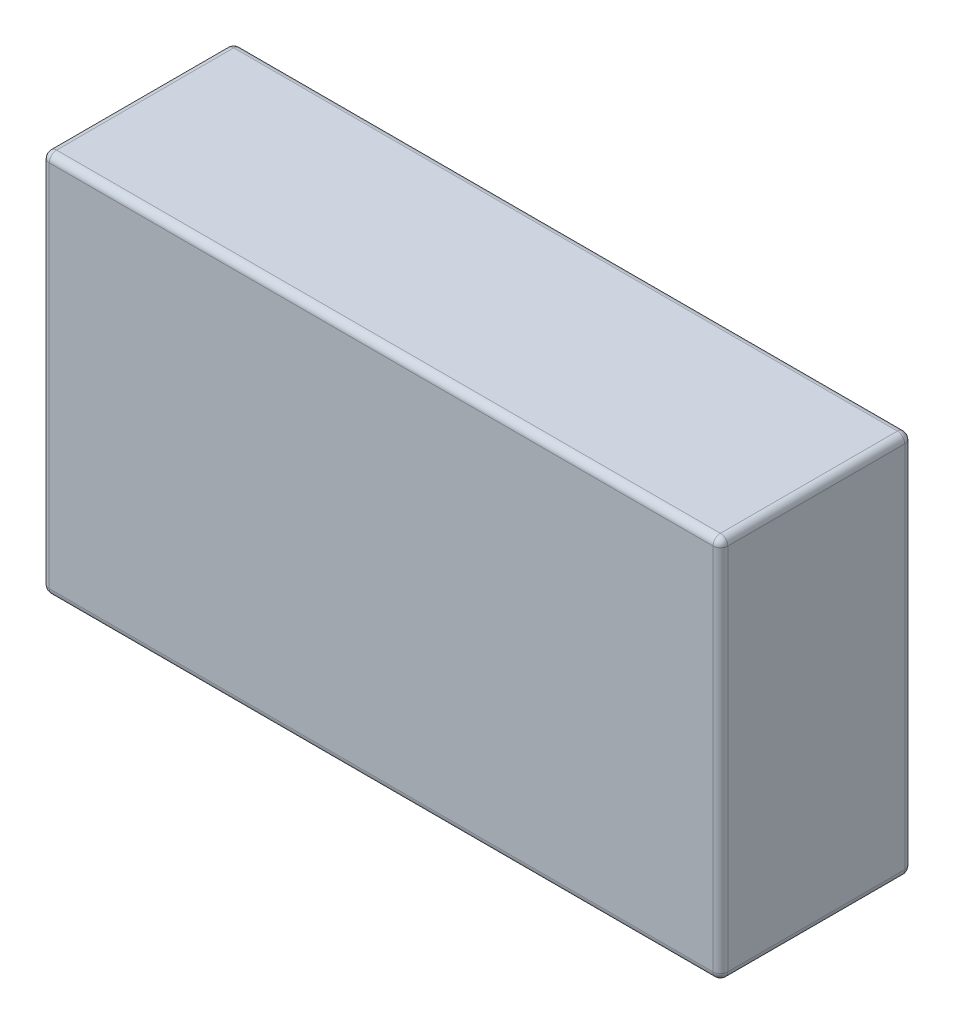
SolidWorks part; units mm, degrees
ref_plane "Alzado" through (0, 0, 0) normal (0, 0, 1) x (1, 0, 0)
ref_plane "Planta" through (0, 0, 0) normal (0, 1, 0) x (1, 0, 0)
ref_plane "Vista lateral" through (0, 0, 0) normal (1, 0, 0) x (0, 0, -1)
sketch "Croquis1" plane through (0, 0, 0) normal (0, 0, 1) x (1, 0, 0)
  line L1 (0, 0) -> (46, 0)
  line L2 (0, 0) -> (0, 26)
  line L3 (0, 26) -> (46, 26)
  line L4 (46, 0) -> (46, 26)
  dimension "D1" = 46
  dimension "D2" = 26
extrude "Saliente-Extruir1" add sketch "Croquis1" along normal blind 13
fillet "Redondeo1" radius 0.5 12 edges at (0, 0, 6.5) (23, 0, 0) (0, 13, 0) (0, 26, 6.5) (23, 26, 0) (46, 0, 6.5) (46, 26, 6.5) (46, 13, 0) (23, 26, 13) (46, 13, 13) (23, 0, 13) (0, 13, 13)
